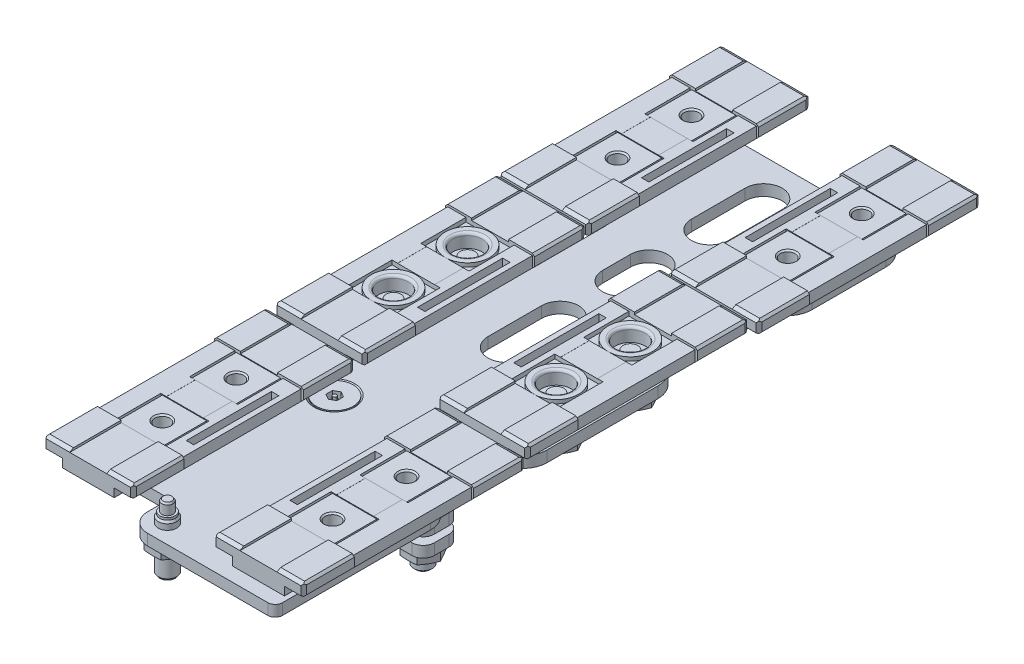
SolidWorks part; units mm, degrees
other "1"
other "brep_55"
other "brep_27"
other "brep_36"
other "brep_35"
other "brep_34"
other "brep_32"
other "brep_28"
other "brep_18"
other "brep_17"
other "brep_37"
other "brep_45"
other "brep_25"
other "brep_19"
other "brep_30"
other "brep_39"
other "brep_26"
other "brep_20"
other "brep_50"
other "brep_38"
other "brep_33"
other "brep_29"
other "brep_53"
other "brep_54"
other "brep_40"
other "brep_31"
ref_plane "Plan de face" through (0, 0, 0) normal (0, 0, 1) x (1, 0, 0)
ref_plane "Plan de dessus" through (0, 0, 0) normal (0, 1, 0) x (1, 0, 0)
ref_plane "Plan de droite" through (0, 0, 0) normal (1, 0, 0) x (0, 0, -1)
imported_body "Importée1"
imported_body "Importée2"
imported_body "Importée3"
imported_body "Importée4"
imported_body "Importée5"
imported_body "Importée6"
imported_body "Importée7"
imported_body "Importée8"
imported_body "Importée9"
imported_body "Importée10"
imported_body "Importée11"
imported_body "Importée12"
imported_body "Importée13"
imported_body "Importée14"
imported_body "Importée15"
imported_body "Importée16"
imported_body "Importée17"
imported_body "Importée18"
imported_body "Importée19"
imported_body "Importée20"
imported_body "Importée21"
imported_body "Importée22"
imported_body "Importée23"
imported_body "Importée24"
imported_body "Importée25"
imported_body "Importée26"
imported_body "Importée27"
imported_body "Importée28"
imported_body "Importée29"
imported_body "Importée30"
imported_body "Importée31"
imported_body "Importée32"
imported_body "Importée33"
imported_body "Importée34"
imported_body "Importée35"
imported_body "Importée36"
imported_body "Importée37"
imported_body "Importée38"
imported_body "Importée39"
imported_body "Importée40"
imported_body "Importée41"
imported_body "Importée42"
imported_body "Importée43"
imported_body "Importée44"
imported_body "Importée45"
imported_body "Importée46"
imported_body "Importée47"
imported_body "Importée48"
imported_body "Importée49"
imported_body "Importée50"
imported_body "Importée51"
imported_body "Importée52"
imported_body "Importée53"
imported_body "Importée54"
imported_body "Importée55"
sketch "Esquisse1" plane through (0, 159.3387, 0) normal (0, -1, 0) x (1, 0, 0)
  line L0 (17.5572, 412.8774) -> (17.5572, 229.8774) construction
  line L1 (-17.4429, 411.8774) -> (-17.4429, 398.9774) construction
  line L2 (52.5573, 398.9774) -> (52.5573, 411.8774) construction
  line L4 (35.5573, 412.8774) -> (29.1343, 412.8774) construction
  line L5 (29.1343, 229.8774) -> (35.5573, 229.8774) construction
sketch "Esquisse2" plane through (0, 159.3387, 0) normal (0, -1, 0) x (1, 0, 0)
  line L0 (3.5572, 355.3778) -> (31.5572, 359.3778) construction
  line L1 (17.5572, 357.3778) -> (41.693, 357.3778) construction
  line L3 (21.5572, 357.3778) -> (13.5572, 357.3778)
  line L4 (21.5572, 357.3778) -> (21.5572, 360.3778)
  line L5 (21.5572, 360.3778) -> (13.5572, 360.3778)
  line L6 (13.5572, 357.3778) -> (13.5572, 360.3778)
  dimension "D1" = 8
  dimension "D2" = 3
revolve "Révolution1" add sketch "Esquisse2" angle 360 about L1
